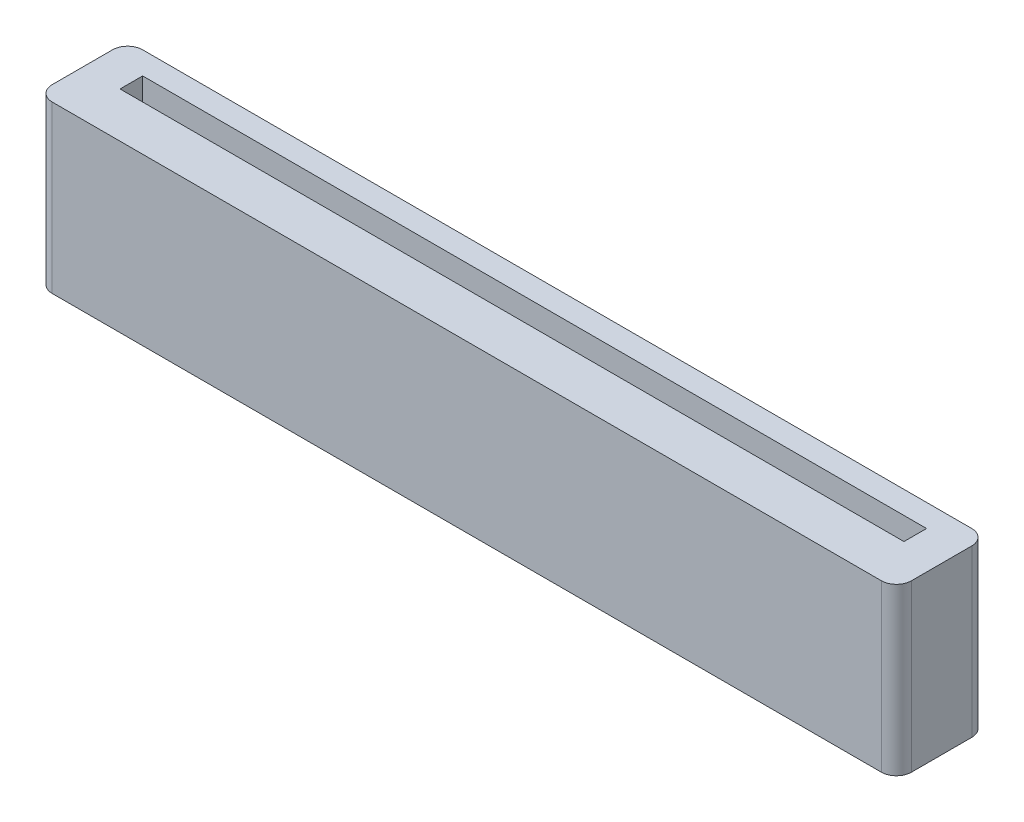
SolidWorks part; units mm, degrees
ref_plane "Plan de face" through (0, 0, 0) normal (0, 0, 1) x (1, 0, 0)
ref_plane "Plan de dessus" through (0, 0, 0) normal (0, 1, 0) x (1, 0, 0)
ref_plane "Plan de droite" through (0, 0, 0) normal (1, 0, 0) x (0, 0, -1)
sketch "Esquisse1" plane through (0, 0, 0) normal (0, 1, 0) x (1, 0, 0)
  line L0 (-41.7684, 0) -> (47.1841, 0) construction
  line L1 (0, -14.69) -> (0, 14.5546) construction
  line L3 (-27.5, 3) -> (27.5, 3)
  line L4 (-28.5, 2) -> (-28.5, -2)
  line L5 (-27.5, -3) -> (27.5, -3)
  line L6 (28.5, 2) -> (28.5, -2)
  arc A0 (27.5, 3) -> (28.5, 2) centre (27.5, 2) cw
  arc A1 (27.5, -3) -> (28.5, -2) centre (27.5, -2) ccw
  arc A2 (-28.5, -2) -> (-27.5, -3) centre (-27.5, -2) ccw
  arc A3 (-27.5, 3) -> (-28.5, 2) centre (-27.5, 2) ccw
  dimension "D3" = 1
  dimension "D1" = 57
  dimension "D2" = 6
extrude "Boss.-Extru.1" add sketch "Esquisse1" along normal blind 11
sketch "Esquisse2" plane through (0, 11, 0) normal (0, 1, 0) x (1, 0, 0)
  line L0 (-31.8109, 0) -> (31.9338, 0) construction
  line L1 (0, -5.9319) -> (0, 5.8089) construction
  line L2 (-26, 1.5) -> (26, 1.5)
  line L3 (-26, 1.5) -> (-26, 0)
  line L4 (-26, 0) -> (26, 0)
  line L5 (26, 1.5) -> (26, 0)
  point P9 (26, 0.75)
  dimension "D1" = 52
  dimension "D2" = 1.5
extrude "Enlèv. mat.-Extru.1" cut sketch "Esquisse2" against normal blind 6
